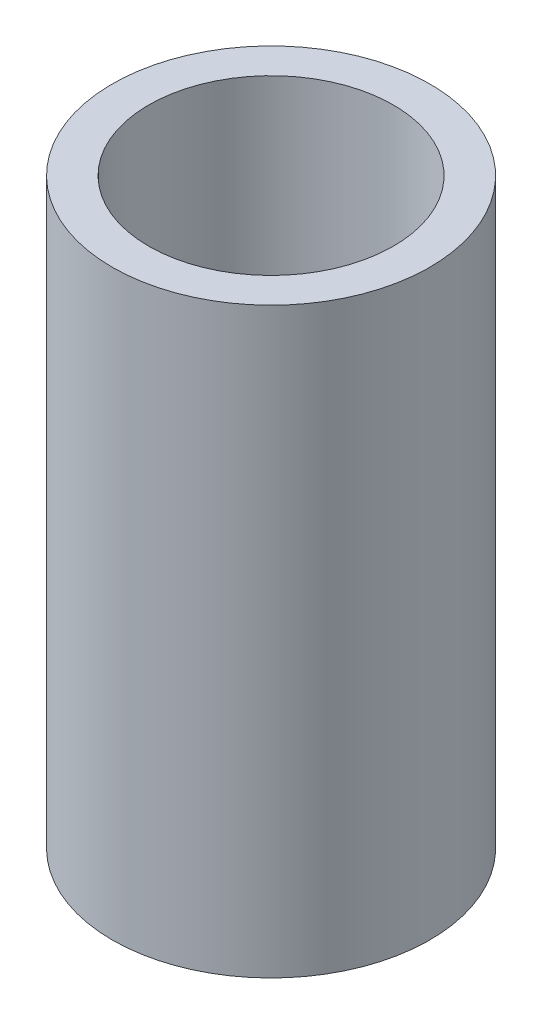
SolidWorks part; units mm, degrees
ref_plane "Front Plane" through (0, 0, 0) normal (0, 0, 1) x (1, 0, 0)
ref_plane "Top Plane" through (0, 0, 0) normal (0, 1, 0) x (1, 0, 0)
ref_plane "Right Plane" through (0, 0, 0) normal (1, 0, 0) x (0, 0, -1)
sketch "Sketch1" plane through (0, 0, 0) normal (0, 1, 0) x (1, 0, 0)
  circle A0 centre (0, 0) radius 16.8
  circle A1 centre (0, 0) radius 21.8
  dimension "D1" = 33.6
  dimension "5" = 5
extrude "Boss-Extrude1" add sketch "Sketch1" along normal blind 80
sketch "Sketch3" plane through (0, 80, 0) normal (0, 1, 0) x (1, 0, 0)
  circle A0 centre (0, 0) radius 21.8
